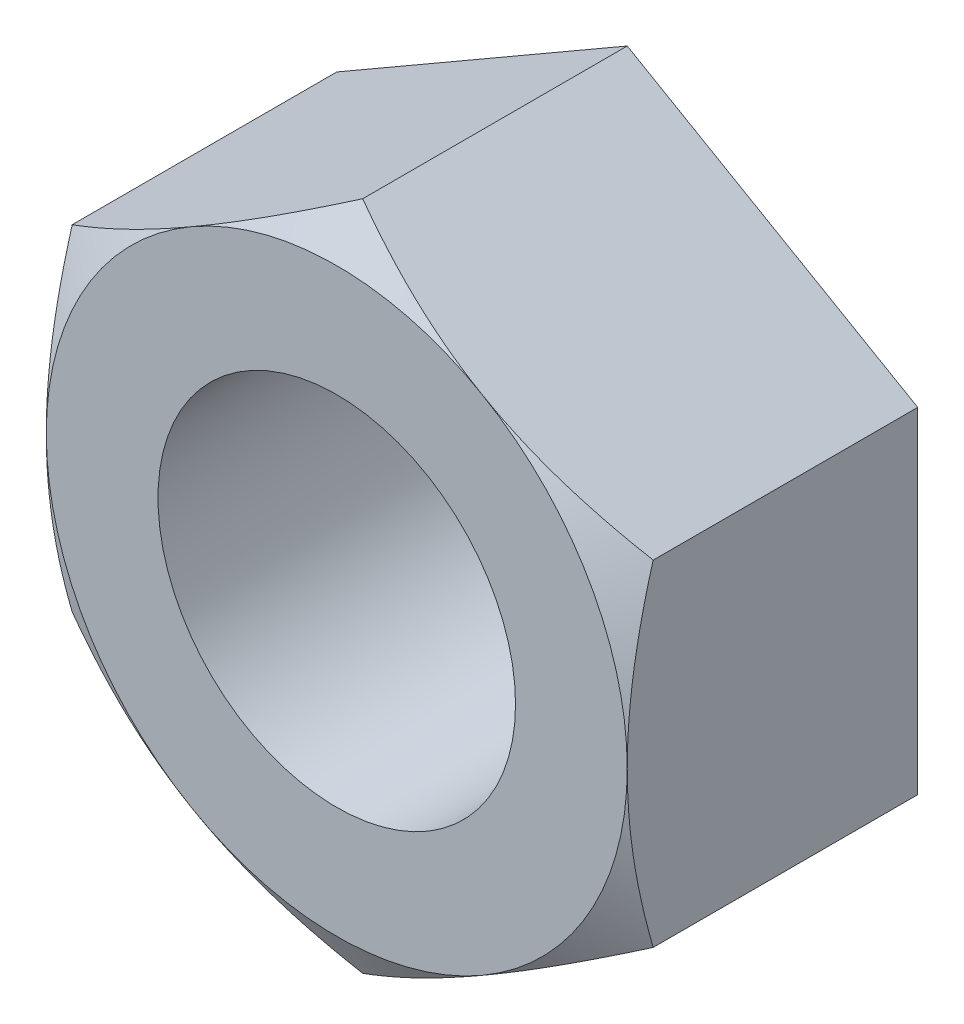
SolidWorks part; units mm, degrees
ref_plane "Front Plane" through (0, 0, 0) normal (0, 0, 1) x (1, 0, 0)
ref_plane "Top Plane" through (0, 0, 0) normal (0, 1, 0) x (1, 0, 0)
ref_plane "Right Plane" through (0, 0, 0) normal (1, 0, 0) x (0, 0, -1)
imported_body "Imported3"
sketch "Sketch1" plane through (0, 0, 5.9194) normal (0, 0, -1) x (-1, 0, 0)
  line L0 (-6.5, -3.7528) -> (-6.5, 3.7528)
  line L1 (-6.5, 3.7528) -> (0, 7.5056)
  line L2 (0, 7.5056) -> (6.5, 3.7528)
  line L3 (6.5, 3.7528) -> (6.5, -3.7528)
  line L4 (6.5, -3.7528) -> (0, -7.5056)
  line L5 (0, -7.5056) -> (-6.5, -3.7528)
extrude "Boss-Extrude1" add sketch "Sketch1" along normal blind 5.9194
hole_wizard "Hole1" positions "Sketch3" profile "Sketch2" legacy
sketch "Sketch3" plane through (0, 0, 6.5) normal (0, 0, 1) x (1, 0, 0)
  point P0 (0, 0)
sketch "Sketch2" plane through (0, 0, 6.5) normal (1, 0, 0) x (0, -1, 0)
  line L0 (0, 0) -> (0, 6.5)
  line L1 (0, 6.5) -> (4, 6.5)
  line L2 (4, 6.5) -> (4, 0)
  line L3 (4, 0) -> (0, 0)
  line L4 (0, 110) -> (0, -10) construction
  dimension "Diameter" = 8
  dimension "Depth" = 6.5
